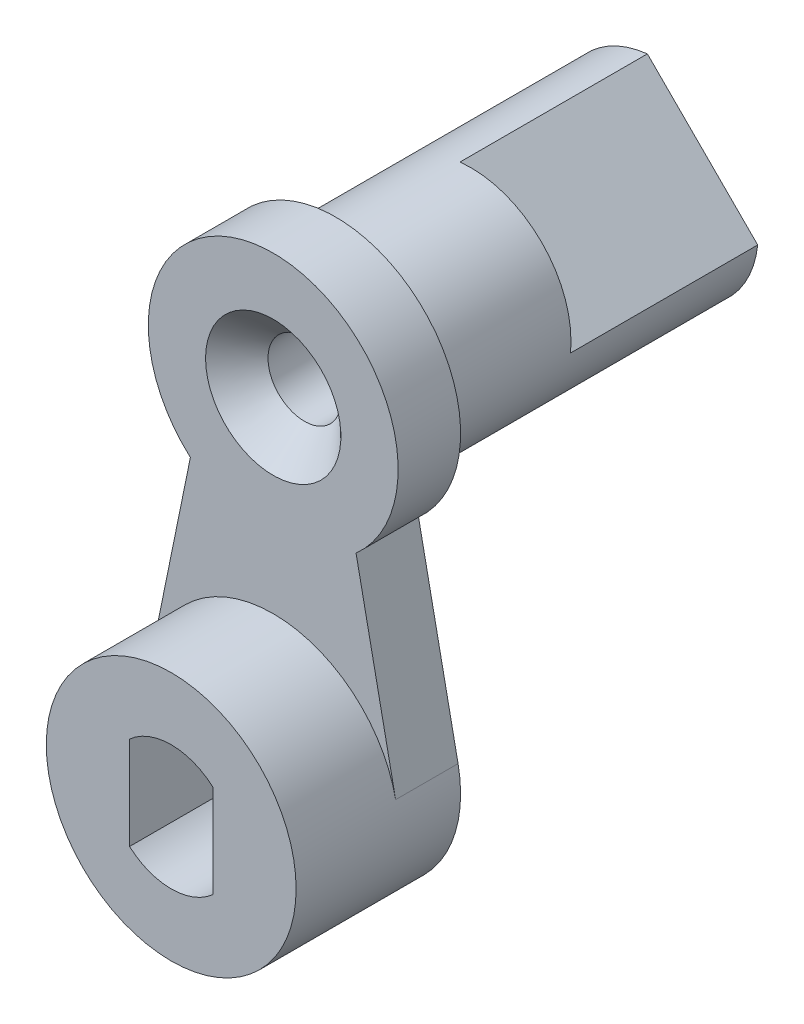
SolidWorks part; units mm, degrees
ref_plane "Plan de face" through (0, 0, 0) normal (0, 0, 1) x (1, 0, 0)
ref_plane "Plan de dessus" through (0, 0, 0) normal (0, 1, 0) x (1, 0, 0)
ref_plane "Plan de droite" through (0, 0, 0) normal (1, 0, 0) x (0, 0, -1)
sketch "Esquisse1" plane through (0, 0, 0) normal (0, 0, 1) x (1, 0, 0)
  line L0 (0, 0) -> (2, 0) construction
  line L1 (0, 0) -> (-2, 0) construction
  line L3 (-2, 2.2361) -> (-2, -2.2361)
  line L4 (2, 2.2361) -> (2, -2.2361)
  circle A0 centre (0, 0) radius 6
  arc A1 (-2, -2.2361) -> (2, -2.2361) centre (0, 0) ccw
  arc A2 (2, 2.2361) -> (-2, 2.2361) centre (0, 0) ccw
  dimension "D1" = 12
  dimension "D2" = 6
  dimension "D3" = 2
  dimension "D4" = 2
extrude "Boss.-Extru.1" add sketch "Esquisse1" along normal blind 7.9
sketch "Esquisse2" plane through (0, 0, 0) normal (0, 0, -1) x (-1, 0, 0)
  line L0 (0, 0) -> (0, 15)
  line L1 (-5.8786, 1.2008) -> (-3.9786, 10.5088)
  line L2 (5.8786, 1.2008) -> (3.9786, 10.5088)
  arc A0 (3.9786, 10.5088) -> (-3.9786, 10.5088) centre (0, 15) ccw
  arc A1 (-5.8786, 1.2008) -> (5.8786, 1.2008) centre (0, 0) ccw
  circle A2 centre (0, 15) radius 3 construction
  circle A3 centre (0, 0) radius 6 construction
  circle A4 centre (0, 15) radius 1.75
  dimension "D2" = 12
  dimension "D3" = 6
  dimension "D4" = 9.5
  dimension "D6" = 3.5
  dimension "D1" = 15
  dimension "D5" = 9.5
extrude "Boss.-Extru.2" add sketch "Esquisse2" against normal blind 3
sketch "Esquisse4" plane through (0, 0, 0) normal (0, 0, -1) x (-1, 0, 0)
  circle A0 centre (0, 15) radius 4.8
  circle A1 centre (0, 15) radius 1.75
  dimension "D1" = 9.6
  dimension "D2" = 3.5
extrude "Boss.-Extru.3" add sketch "Esquisse4" along normal blind 6.5
sketch "Esquisse6" plane through (0, 0, -6.5) normal (0, 0, -1) x (-1, 0, 0)
  line L0 (0, 15) -> (0, 10.2) construction
  line L1 (0, 15) -> (-3.3941, 11.6059)
  line L2 (0, 15) -> (-2.1213, 17.1213)
  line L3 (0, 15) -> (2.1213, 12.8787)
  line L4 (2.1213, 12.8787) -> (4.7708, 15.5282)
  line L5 (2.1213, 12.8787) -> (-0.5282, 10.2292)
  line L6 (-2.1213, 17.1213) -> (0.5282, 19.7708)
  line L7 (-2.1213, 17.1213) -> (-4.7708, 14.4718)
  circle A0 centre (0, 15) radius 4.8 construction
  circle A1 centre (0, 15) radius 4.8 construction
  dimension "D1" = 45
  dimension "D2" = 90
  dimension "D3" = 90
  dimension "D4" = 3
  dimension "D5" = 3
  dimension "D6" = 3.747
  dimension "D7" = 3.747
extrude "Boss.-Extru.4" add sketch "Esquisse6" along normal blind 9 contours L6 L2 L3 L4 M8 | L0 L1 L5 M8 | L3 L0 L5 | L2 L7 L1 M8
chamfer "Chanfrein1" distance 1.5 angle 45 1 edges at (-1.75, 15, 3)
